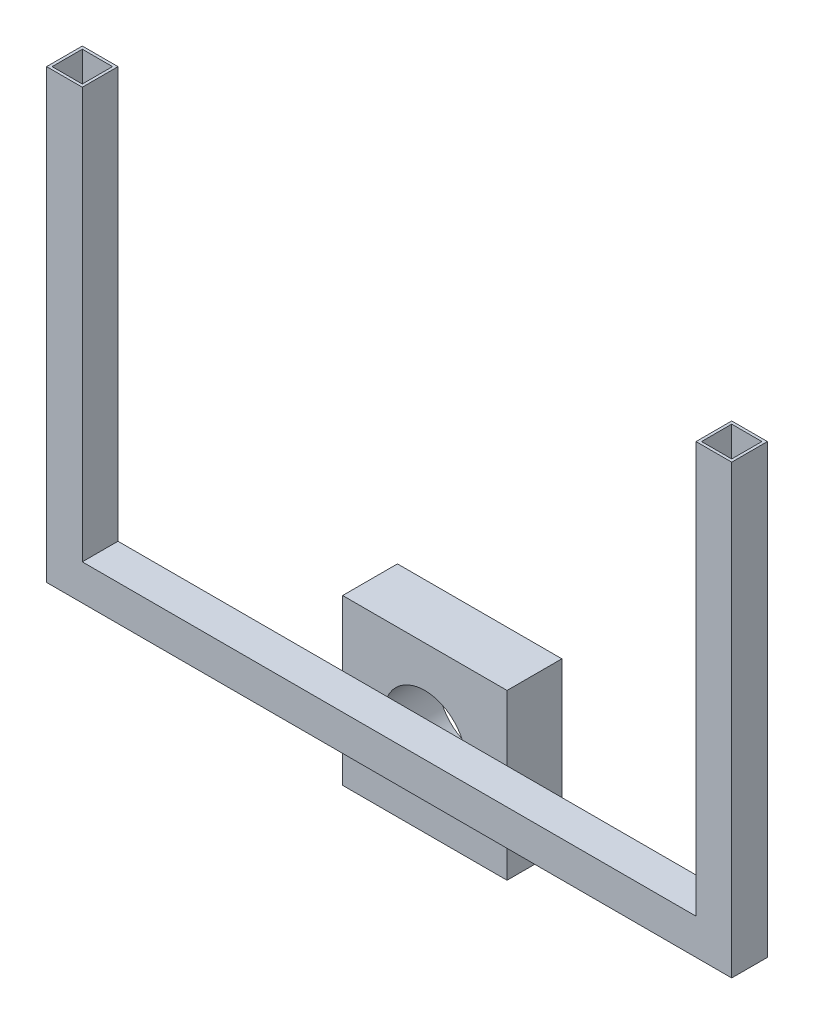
SolidWorks part; units mm, degrees
ref_plane "Front Plane" through (0, 0, 0) normal (0, 0, 1) x (1, 0, 0)
ref_plane "Top Plane" through (0, 0, 0) normal (0, 1, 0) x (1, 0, 0)
ref_plane "Right Plane" through (0, 0, 0) normal (1, 0, 0) x (0, 0, -1)
sketch "Sketch1" plane through (0, 0, 0) normal (0, 1, 0) x (1, 0, 0)
  line L1 (0, 0) -> (250, 0)
  line L2 (0, 0) -> (0, 13.022)
  line L3 (0, 13.022) -> (250, 13.022)
  line L4 (250, 0) -> (250, 13.022)
  dimension "D1" = 250
  dimension "D2" = 13.022
extrude "Boss-Extrude1" add sketch "Sketch1" along normal blind 13.022
sketch "Sketch2" plane through (0, 13.022, 0) normal (0, 1, 0) x (1, 0, 0)
  line L0 (250, 13.022) -> (0, 13.022) construction
  line L1 (0, 0) -> (13.022, 0)
  line L2 (0, 0) -> (0, 13.022)
  line L3 (0, 13.022) -> (13.022, 13.022)
  line L4 (13.022, 0) -> (13.022, 13.022)
  line L6 (250, 0) -> (236.978, 0)
  line L7 (250, 0) -> (250, 13.022)
  line L8 (250, 13.022) -> (236.978, 13.022)
  line L9 (236.978, 0) -> (236.978, 13.022)
  dimension "D1" = 13.022
  dimension "D2" = 13.022
extrude "Boss-Extrude2" add sketch "Sketch2" along normal blind 150
sketch "Sketch3" plane through (0, 0, -13.022) normal (0, 0, -1) x (-1, 0, 0)
  line L0 (-236.978, 13.022) -> (0, 0) construction
  line L1 (-13.022, 13.022) -> (-250, 0) construction
  line L3 (-155, -23.1312) -> (-95, -23.1312)
  line L4 (-155, -23.1312) -> (-155, 36.8688)
  line L5 (-155, 36.8688) -> (-95, 36.8688)
  line L6 (-95, -23.1312) -> (-95, 36.8688)
  line L7 (-155, -23.1312) -> (-95, 36.8688) construction
  line L8 (-155, 36.8688) -> (-95, -23.1312) construction
  point P8 (-125, 6.8688)
  point P9 (-125, 6.8688)
  dimension "D1" = 60
  dimension "D2" = 60
extrude "Boss-Extrude3" add sketch "Sketch3" along normal blind 20
sketch "Sketch4" plane through (0, 0, -33.022) normal (0, 0, -1) x (-1, 0, 0)
  line L0 (-155, 36.8688) -> (-95, -23.1312) construction
  line L1 (-95, -23.1312) -> (-95, 36.8688) construction
  line L2 (-95, 36.8688) -> (-155, -23.1312) construction
  line L3 (-155, -23.1312) -> (-155, 36.8688) construction
  circle A0 centre (-125, 6.8688) radius 15
  dimension "D1" = 30
extrude "Cut-Extrude1" cut sketch "Sketch4" against normal blind 20
sketch "Sketch5" plane through (0, 163.022, 0) normal (0, 1, 0) x (1, 0, 0)
  line L0 (0, 0) -> (13.022, 13.022) construction
  line L1 (13.022, 13.022) -> (13.022, 0) construction
  line L2 (13.022, 0) -> (0, 13.022) construction
  line L3 (0, 13.022) -> (13.022, 13.022) construction
  line L4 (236.978, 13.022) -> (250, 0) construction
  line L5 (250, 0) -> (250, 13.022) construction
  line L6 (250, 13.022) -> (236.978, 0) construction
  line L8 (237.9812, 1.0032) -> (248.9968, 1.0032)
  line L9 (237.9812, 1.0032) -> (237.9812, 12.0188)
  line L10 (237.9812, 12.0188) -> (248.9968, 12.0188)
  line L11 (248.9968, 1.0032) -> (248.9968, 12.0188)
  line L12 (237.9812, 1.0032) -> (248.9968, 12.0188) construction
  line L13 (237.9812, 12.0188) -> (248.9968, 1.0032) construction
  line L14 (1.0032, 1.0032) -> (12.0188, 1.0032)
  line L15 (1.0032, 1.0032) -> (1.0032, 12.0188)
  line L16 (1.0032, 12.0188) -> (12.0188, 12.0188)
  line L17 (12.0188, 1.0032) -> (12.0188, 12.0188)
  line L18 (1.0032, 1.0032) -> (12.0188, 12.0188) construction
  line L19 (1.0032, 12.0188) -> (12.0188, 1.0032) construction
  point P12 (243.489, 6.511)
  point P21 (6.511, 6.511)
extrude "Cut-Extrude2" cut sketch "Sketch5" against normal blind 160
